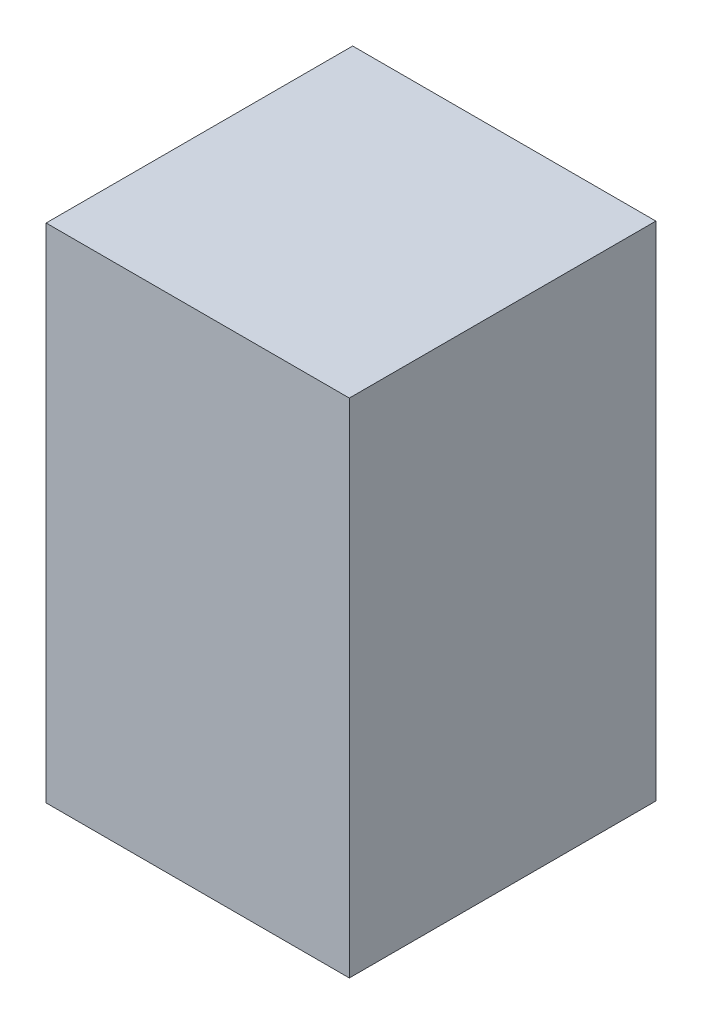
SolidWorks part; units mm, degrees
ref_plane "Ebene vorne" through (0, 0, 0) normal (0, 0, 1) x (1, 0, 0)
ref_plane "Ebene oben" through (0, 0, 0) normal (0, 1, 0) x (1, 0, 0)
ref_plane "Ebene rechts" through (0, 0, 0) normal (1, 0, 0) x (0, 0, -1)
sketch "Skizze1" plane through (0, 0, 0) normal (0, 1, 0) x (1, 0, 0)
  line L1 (0, 0) -> (30.1875, 0)
  line L2 (0, 0) -> (0, 30.5181)
  line L3 (0, 30.5181) -> (30.1875, 30.5181)
  line L4 (30.1875, 0) -> (30.1875, 30.5181)
extrude "Linear austragen1" add sketch "Skizze1" along normal blind 50
